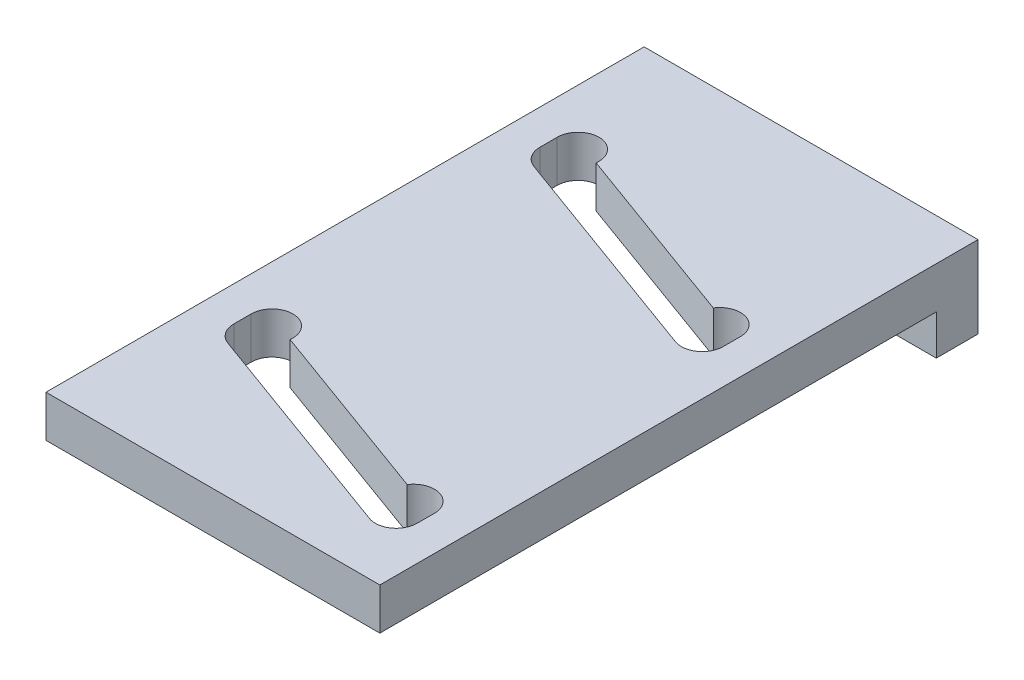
SolidWorks part; units mm, degrees
ref_plane "Front Plane" through (0, 0, 0) normal (0, 0, 1) x (1, 0, 0)
ref_plane "Top Plane" through (0, 0, 0) normal (0, 1, 0) x (1, 0, 0)
ref_plane "Right Plane" through (0, 0, 0) normal (1, 0, 0) x (0, 0, -1)
sketch "Sketch1" plane through (0, 0, 0) normal (0, 1, 0) x (1, 0, 0)
  line L1 (-38.1, 127) -> (38.1, 127)
  line L2 (-38.1, 127) -> (-38.1, 0)
  line L3 (-38.1, 0) -> (38.1, 0)
  line L4 (38.1, 127) -> (38.1, 0)
  dimension "D1" = 76.2
  dimension "D2" = 127
extrude "Boss-Extrude1" add sketch "Sketch1" along normal mid plane 9.525
sketch "Sketch2" plane through (0, 4.7625, 0) normal (0, 1, 0) x (1, 0, 0)
  line L0 (-23.7711, 109.2503) -> (27.0289, 90.7606)
  line L1 (27.0289, 90.7606) -> (23.7711, 81.81) construction
  line L2 (23.7711, 81.81) -> (-27.0289, 100.2997)
  line L3 (-27.0289, 100.2997) -> (-23.7711, 109.2503) construction
  line L4 (-23.7711, 39.4003) -> (27.0289, 20.9106)
  line L5 (27.0289, 20.9106) -> (23.7711, 11.96) construction
  line L6 (23.7711, 11.96) -> (-27.0289, 30.4497)
  line L7 (-27.0289, 30.4497) -> (-23.7711, 39.4003) construction
  line L8 (-38.1, 0) -> (38.1, 0) construction
  line L9 (-38.1, 127) -> (-38.1, 0) construction
  line L10 (38.1, 0) -> (38.1, 127) construction
  arc A0 (-27.0289, 100.2997) -> (-23.7711, 109.2503) centre (-25.4, 104.775) cw
  arc A1 (27.0289, 90.7606) -> (23.7711, 81.81) centre (25.4, 86.2853) cw
  arc A2 (-27.0289, 30.4497) -> (-23.7711, 39.4003) centre (-25.4, 34.925) cw
  arc A3 (23.7711, 11.96) -> (27.0289, 20.9106) centre (25.4, 16.4353) ccw
  dimension "D1" = 9.525
  dimension "D2" = 12.7
  dimension "D3" = 69.85
  dimension "D4" = 34.925
  dimension "D5" = 12.7
  dimension "D6" = 20
  dimension "D7" = 54.0602
extrude "Cut-Extrude1" cut sketch "Sketch2" against normal through all
sketch "Sketch3" plane through (0, 4.7625, 0) normal (0, 1, 0) x (1, 0, 0)
  line L0 (-30.1625, 108.7438) -> (-30.1625, 104.775)
  line L1 (-30.1625, 104.775) -> (-20.6375, 104.775)
  line L2 (-20.6375, 104.775) -> (-20.6375, 108.7438)
  line L3 (-20.6375, 108.7438) -> (-30.1625, 108.7438) construction
  line L4 (-27.0289, 100.2997) -> (-23.7711, 109.2503) construction
  line L5 (-30.1625, 34.925) -> (-30.1625, 38.8938)
  line L6 (-30.1625, 38.8938) -> (-20.6375, 38.8938) construction
  line L7 (-20.6375, 38.8938) -> (-20.6375, 34.925)
  line L8 (-20.6375, 34.925) -> (-30.1625, 34.925)
  arc A0 (-23.7711, 109.2503) -> (-27.0289, 100.2997) centre (-25.4, 104.775) ccw construction
  arc A1 (-30.1625, 108.7438) -> (-20.6375, 108.7438) centre (-25.4, 108.7438) cw
  arc A2 (-30.1625, 38.8938) -> (-20.6375, 38.8938) centre (-25.4, 38.8938) cw
  arc A3 (-23.7711, 39.4003) -> (-27.0289, 30.4497) centre (-25.4, 34.925) ccw construction
  dimension "D1" = 3.9688
extrude "Cut-Extrude2" cut sketch "Sketch3" against normal through all
pattern_linear "LPattern1" count 2 spacing 54.0602 along (0.9397, 0, 0.342) of "Cut-Extrude2"
sketch "Sketch4" plane through (0, 0, -127) normal (0, 0, -1) x (-1, 0, 0)
  line L0 (-38.1, 4.7625) -> (-38.1, -4.7625) construction
  line L1 (38.1, 4.7625) -> (-38.1, 4.7625)
  line L2 (38.1, 4.7625) -> (38.1, -13.9065)
  line L3 (38.1, -13.9065) -> (-38.1, -13.9065)
  line L4 (-38.1, 4.7625) -> (-38.1, -13.9065)
  dimension "D1" = 18.669
extrude "Boss-Extrude2" add sketch "Sketch4" along normal blind 9.525
